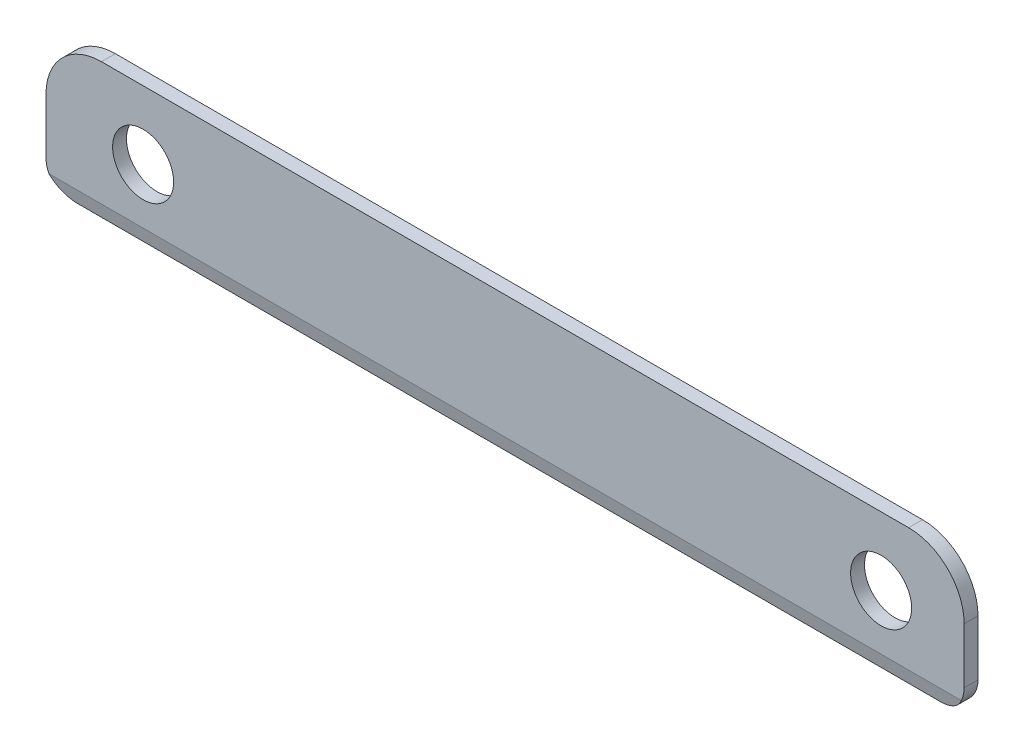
SolidWorks part; units mm, degrees
ref_plane "Płaszczyzna przednia" through (0, 0, 0) normal (0, 0, 1) x (1, 0, 0)
ref_plane "Płaszczyzna górna" through (0, 0, 0) normal (0, 1, 0) x (1, 0, 0)
ref_plane "Płaszczyzna prawa" through (0, 0, 0) normal (1, 0, 0) x (0, 0, -1)
sketch "Szkic1" plane through (0, 0, 0) normal (0, 0, 1) x (1, 0, 0)
  line L0 (-165.0736, -15.6832) -> (-165.0736, 4.3168)
  line L1 (-145.0736, 24.3168) -> (145.8452, 24.3168)
  line L2 (165.8452, -15.6832) -> (165.8452, 4.3168)
  line L3 (-155.0736, -25.6832) -> (155.8452, -25.6832)
  circle A0 centre (-130.0736, -0.2631) radius 11
  circle A1 centre (135.9264, -0.2631) radius 11
  arc A2 (165.8452, 4.3168) -> (145.8452, 24.3168) centre (145.8452, 4.3168) ccw
  arc A3 (-165.0736, 4.3168) -> (-145.0736, 24.3168) centre (-145.0736, 4.3168) cw
  arc A4 (165.8452, -15.6832) -> (155.8452, -25.6832) centre (155.8452, -15.6832) cw
  arc A5 (-165.0736, -15.6832) -> (-155.0736, -25.6832) centre (-155.0736, -15.6832) ccw
  dimension "D2" = 20
  dimension "D4" = 22
  dimension "D5" = 10
  dimension "D6" = 266
  dimension "D1" = 50
  dimension "D3" = 330.9188
extrude "Dodanie-wyciągnięcie1" add sketch "Szkic1" along normal blind 5
sketch "Szkic2" plane through (-165.0736, 0, 0) normal (-1, 0, 0) x (0, 0, 1)
  line L0 (5, -20.1091) -> (3.578, -25.6832)
  line L1 (5, -25.6832) -> (5, -15.6832) construction
  line L2 (5, -25.6832) -> (0, -25.6832) construction
  line L3 (3.578, -25.6832) -> (5, -25.6832)
  line L4 (5, -25.6832) -> (5, -20.1091)
extrude "Wytnij-wyciągnięcie1" cut sketch "Szkic2" against normal through all
